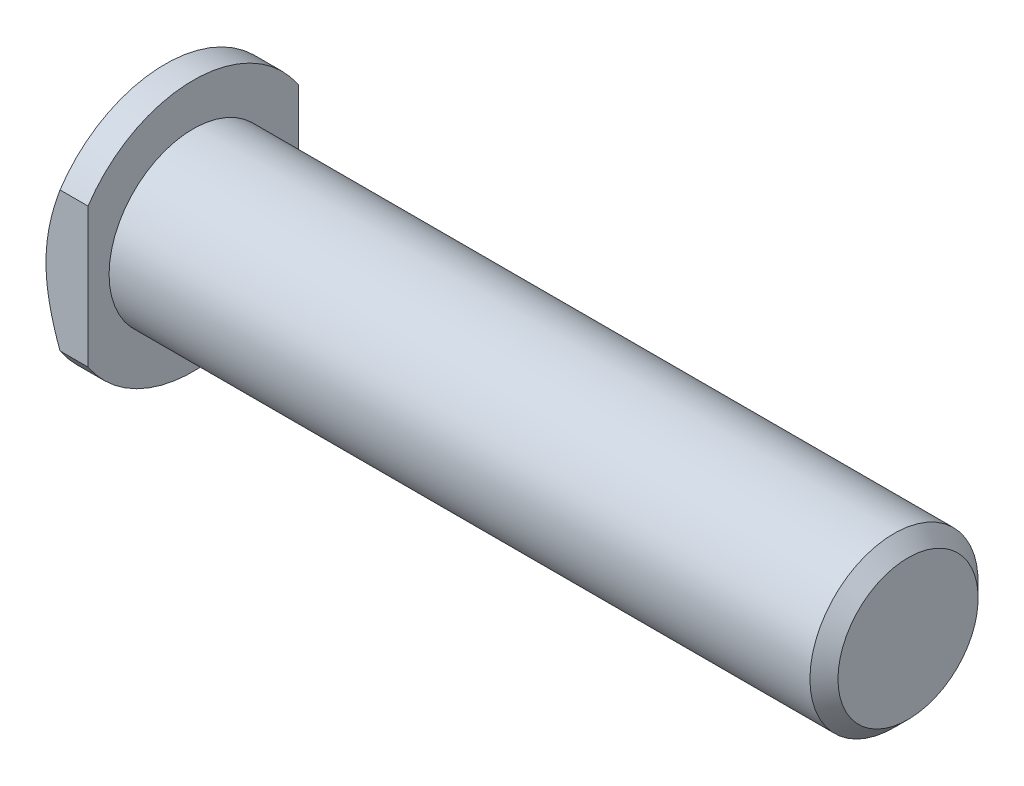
SolidWorks part; units mm, degrees
ref_plane "Plan de face" through (0, 0, 0) normal (0, 0, 1) x (1, 0, 0)
ref_plane "Plan de dessus" through (0, 0, 0) normal (0, 1, 0) x (1, 0, 0)
ref_plane "Plan de droite" through (0, 0, 0) normal (1, 0, 0) x (0, 0, -1)
sketch "Esquisse1" plane through (0, 0, 0) normal (0, 0, 1) x (1, 0, 0)
  line L0 (0, 0) -> (110, 0)
  line L1 (110, 0) -> (110, 12)
  line L2 (110, 12) -> (8, 12)
  line L3 (8, 12) -> (8, 18)
  line L4 (8, 18) -> (0, 18)
  line L5 (0, 18) -> (0, 0)
  dimension "D1" = 12
  dimension "D2" = 110
  dimension "D3" = 102
  dimension "D4" = 18
revolve "Révolution1" add sketch "Esquisse1" angle 360 about L0
chamfer "Chanfrein1" distance 4 distance2 6 1 edges at (0, 0, 18)
sketch "Esquisse2" plane through (0, 0, 0) normal (-1, 0, 0) x (0, 0, 1)
  line L1 (-15, 17.8551) -> (-29.5145, 17.8551)
  line L2 (-15, 17.8551) -> (-15, -17.809)
  line L3 (-15, -17.809) -> (-29.5145, -17.809)
  line L4 (-29.5145, 17.8551) -> (-29.5145, -17.809)
  dimension "D1" = 15
extrude "Enlèv. mat.-Extru.1" cut sketch "Esquisse2" against normal up to surface (8 mm away)
mirror "Symétrie1" about plane through (0, 0, 0) normal (0, 0, 1) of "Enlèv. mat.-Extru.1"
chamfer "Chanfrein2" distance 2 angle 45 1 edges at (110, 0, 12)
